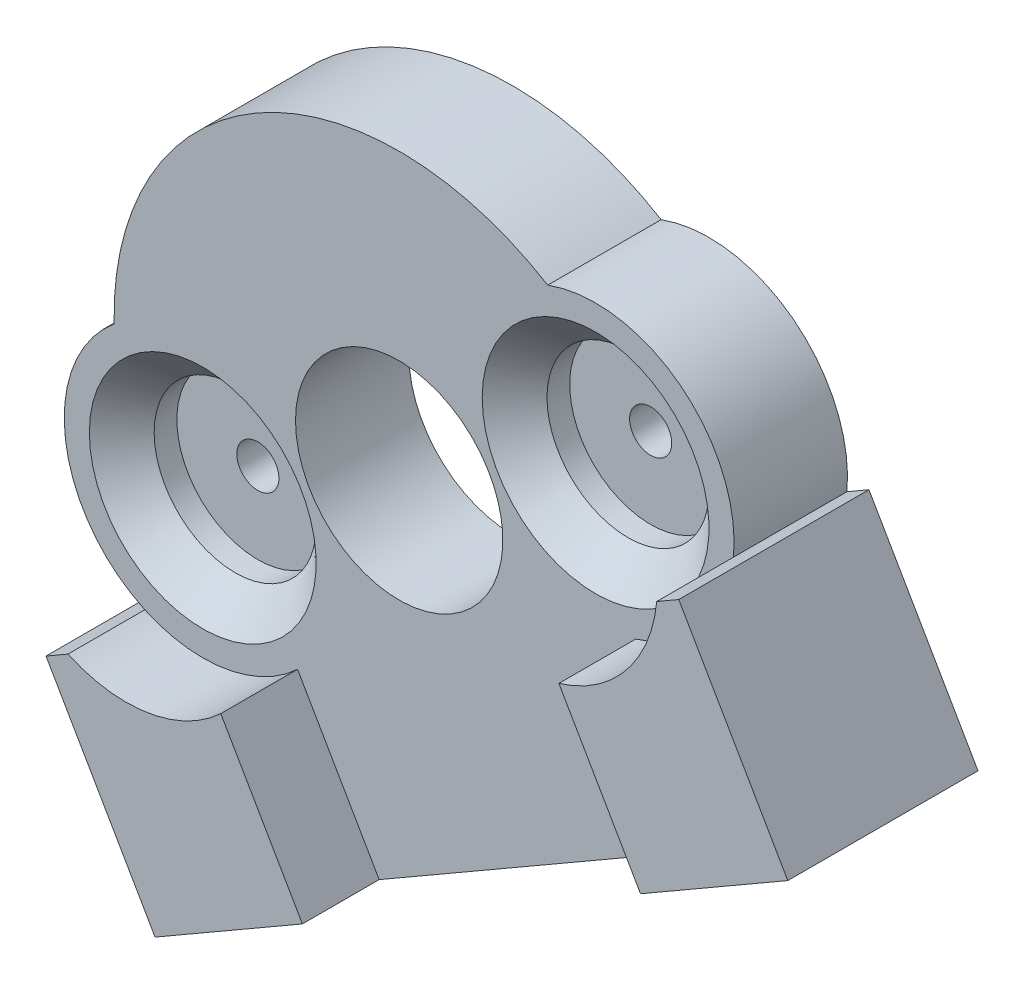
SolidWorks part; units mm, degrees
ref_plane "Plan de face" through (0, 0, 0) normal (0, 0, 1) x (1, 0, 0)
ref_plane "Plan de dessus" through (0, 0, 0) normal (0, 1, 0) x (1, 0, 0)
ref_plane "Plan de droite" through (0, 0, 0) normal (1, 0, 0) x (0, 0, -1)
sketch "Esquisse1" plane through (0, 0, 0) normal (0, 0, 1) x (1, 0, 0)
  line L0 (6.0622, -3.5) -> (0, -7) construction
  line L1 (6, -10.3923) -> (-6, 10.3923) construction
  line L2 (14.3644, -2.3299) -> (-5.1644, -13.6049)
  line L3 (14.3644, -2.3299) -> (10.9985, 3.5)
  line L4 (10.9985, 3.5) -> (10.3191, 3.1078)
  line L5 (-5.1644, -13.6049) -> (-8.5304, -7.775)
  line L6 (-8.5304, -7.775) -> (-7.851, -7.3828)
  circle A0 centre (0, 0) radius 3.2
  arc A1 (-7.851, -7.3828) -> (-8.7974, -0.2145) centre (-6.0622, -3.5) cw
  circle A2 centre (6.0622, 3.5) radius 0.65 construction
  circle A3 centre (-6.0622, -3.5) radius 0.65 construction
  circle A4 centre (6.0622, 3.5) radius 0.65
  circle A5 centre (-6.0622, -3.5) radius 0.65
  arc A6 (10.3191, 3.1078) -> (4.5845, 7.5115) centre (6.0622, 3.5) ccw
  circle A7 centre (0, 0) radius 12 construction
  circle A8 centre (0, 0) radius 12 construction
  arc A9 (4.5845, 7.5115) -> (-8.7974, -0.2145) centre (0, 0) ccw
  point P21 (4.6, -7.9674)
  dimension "D1" = 6.4
  dimension "D2" = 9.2
  dimension "D5" = 11.275
extrude "Extrusion1" add sketch "Esquisse1" along normal blind 5.87
sketch "Esquisse2" plane through (0, 0, 0) normal (0, 0, -1) x (-1, 0, 0)
  circle A0 centre (0, 7) radius 0.65 construction
  circle A1 centre (0, 7) radius 0.65
  circle A2 centre (0, -7) radius 0.65 construction
  circle A3 centre (0, -7) radius 0.65
extrude "Extrusion2" add sketch "Esquisse2" along normal blind 1
sketch "Esquisse3" plane through (0, 0, 5.87) normal (0, 0, 1) x (1, 0, 0)
  line L0 (-3.1366, -6.6172) -> (-0.6178, -10.9799)
  line L1 (0, 0) -> (4.18, -7.24) construction
  line L2 (7.299, -0.5922) -> (9.8178, -4.9549)
  line L5 (-7.851, -7.3828) -> (-8.5304, -7.775)
  line L6 (-8.5304, -7.775) -> (-5.1644, -13.6049)
  line L7 (-5.1644, -13.6049) -> (14.3644, -2.3299)
  line L8 (14.3644, -2.3299) -> (10.9985, 3.5)
  line L9 (10.9985, 3.5) -> (10.3191, 3.1078)
  line L12 (-0.6178, -10.9799) -> (9.8178, -4.9549)
  circle A0 centre (0, 0) radius 3.2 construction
  circle A1 centre (-6.0622, -3.5) radius 0.65 construction
  circle A2 centre (6.0622, 3.5) radius 0.65 construction
  arc A3 (-8.7974, -0.2145) -> (-7.851, -7.3828) centre (-6.0622, -3.5) ccw
  arc A4 (10.3191, 3.1078) -> (4.5845, 7.5115) centre (6.0622, 3.5) ccw
  arc A5 (4.5845, 7.5115) -> (-8.7974, -0.2145) centre (0, 0) ccw
  arc A6 (-8.7974, -0.2145) -> (-7.851, -7.3828) centre (-6.0622, -3.5) ccw
  arc A7 (4.5845, 7.5115) -> (7.299, -0.5922) centre (6.0622, 3.5) cw
  arc A8 (4.5845, 7.5115) -> (-8.7974, -0.2145) centre (0, 0) ccw
  circle A9 centre (0, 0) radius 3.2
  circle A10 centre (-6.0622, -3.5) radius 0.65
  circle A11 centre (6.0622, 3.5) radius 0.65
  arc A12 (-8.7974, -0.2145) -> (-3.1366, -6.6172) centre (-6.0622, -3.5) ccw
  dimension "D1" = 0
extrude "Enlèv. mat.-Extru.4" cut sketch "Esquisse3" against normal offset from surface (2.37 mm away) 3.5
sketch "Esquisse4" plane through (0, 0, 3.5) normal (0, 0, 1) x (1, 0, 0)
  circle A0 centre (6.0622, 3.5) radius 2.5
  circle A1 centre (-6.0622, -3.5) radius 2.5
  dimension "D1" = 5
extrude "Enlèv. mat.-Extru.5" cut sketch "Esquisse4" against normal blind 1.7
chamfer "Chanfrein1" distance 1 angle 45 2 edges at (8.5622, 3.5, 3.5) (-3.5622, -3.5, 3.5)
sketch "Esquisse5" plane through (4.6, -7.9674, 0) normal (0.5, -0.866, 0) x (0.866, 0.5, 0)
  line L8 (6.025, 3.5) -> (-6.025, 3.5)
  line L9 (-6.025, 3.5) -> (-6.025, 5.87)
  line L10 (-6.025, 5.87) -> (-11.275, 5.87)
  line L11 (-11.275, 5.87) -> (-11.275, 0)
  line L12 (-11.275, 0) -> (11.275, 0)
  line L13 (11.275, 0) -> (11.275, 5.87)
  line L14 (11.275, 5.87) -> (6.025, 5.87)
  line L15 (6.025, 5.87) -> (6.025, 3.5)
  line L16 (6.025, 3.5) -> (-6.025, 3.5)
  line L17 (-6.025, 3.5) -> (-6.025, 5.87)
  line L18 (-6.025, 5.87) -> (-11.275, 5.87)
  line L19 (-11.275, 5.87) -> (-11.275, 0)
  line L20 (-11.275, 0) -> (11.275, 0)
  line L21 (11.275, 0) -> (11.275, 5.87)
  line L22 (11.275, 5.87) -> (6.025, 5.87)
  line L23 (6.025, 5.87) -> (6.025, 3.5)
  dimension "D1" = 0
sketch "Esquisse7" plane through (4.6, -7.9674, 0) normal (0.5, -0.866, 0) x (0.866, 0.5, 0)
  circle A0 centre (-8.4963, 2.5369) radius 1.2
  circle A1 centre (8.9037, 2.5369) radius 1.1863
  circle A2 centre (5.2037, 1.0724) radius 0.65
  circle A3 centre (-4.7963, 1.0724) radius 0.65
extrude "Enlèv. mat.-Extru.6" cut sketch "Esquisse7" against normal blind 3
